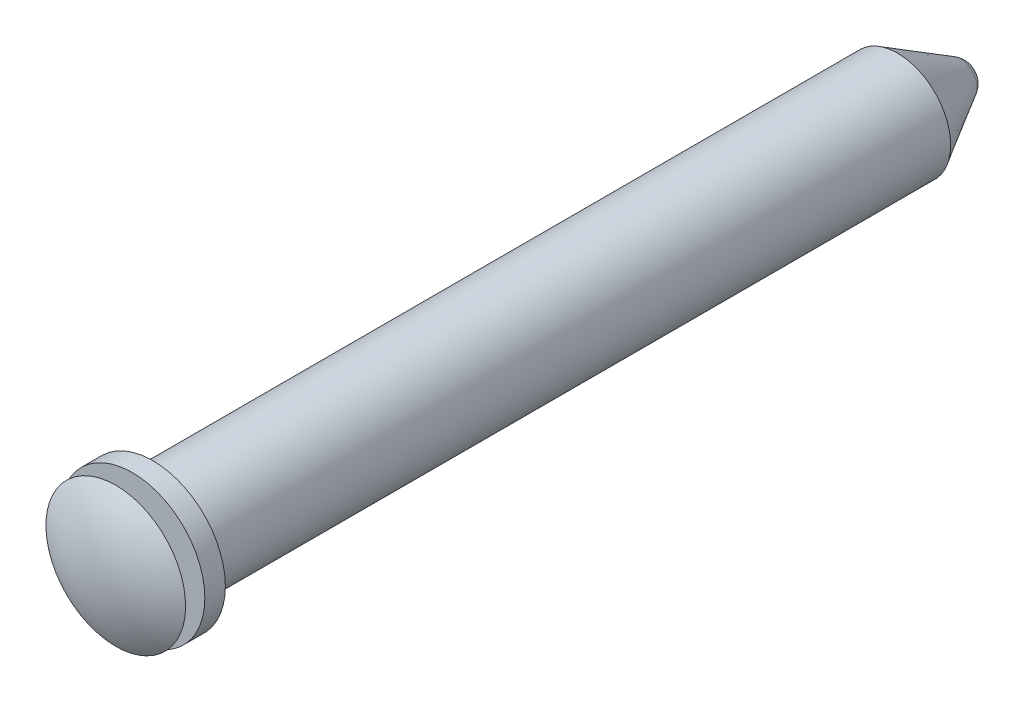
SolidWorks part; units mm, degrees
ref_plane "Спереди" through (0, 0, 0) normal (0, 0, 1) x (1, 0, 0)
ref_plane "Сверху" through (0, 0, 0) normal (0, 1, 0) x (1, 0, 0)
ref_plane "Справа" through (0, 0, 0) normal (1, 0, 0) x (0, 0, -1)
sketch "Эскиз1" plane through (0, 0, 0) normal (1, 0, 0) x (0, 0, -1)
  line L0 (0, 0) -> (61.597, 0) construction
  line L1 (0, 0) -> (33.5026, 0)
  line L2 (33.1319, 0.6421) -> (30.7245, 2.032)
  line L3 (30.7245, 2.032) -> (2.4892, 2.032)
  line L4 (2.1844, 2.3368) -> (2.1844, 2.7781)
  line L5 (2.1844, 2.7781) -> (1.397, 2.7781)
  line L6 (1.397, 2.7781) -> (1.397, 1.5875)
  line L7 (1.397, 1.5875) -> (0.762, 1.5875)
  line L8 (0.762, 1.5875) -> (0.762, 2.6761)
  arc A0 (0, 0) -> (0.762, 2.6761) centre (5.08, 0) cw
  arc A1 (33.5026, 0) -> (33.1319, 0.6421) centre (32.7612, 0) ccw
  arc A2 (2.4892, 2.032) -> (2.1844, 2.3368) centre (2.4892, 2.3368) cw
  dimension "D5" = 5.08
  dimension "D11" = 0.3048
  dimension "D1" = 3.175
  dimension "D2" = 4.064
  dimension "D3" = 30
  dimension "D4" = 5.5562
  dimension "D6" = 0.635
  dimension "D7" = 0.7874
  dimension "D8" = 31.3182
  dimension "D9" = 2.7781
  dimension "D10" = 0.762
revolve "Повернуть1" add sketch "Эскиз1" angle 360 about L0
